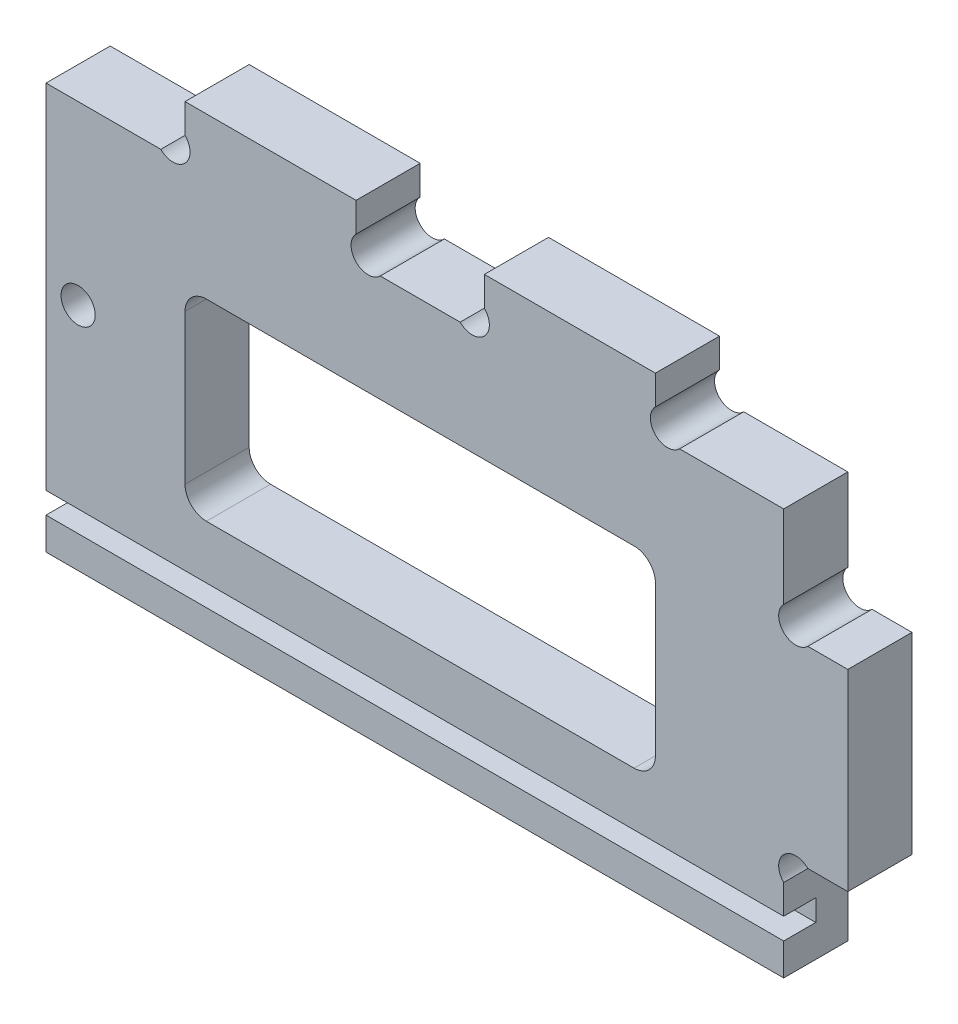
SolidWorks part; units mm, degrees
ref_plane "Plan de face" through (0, 0, 0) normal (0, 0, 1) x (1, 0, 0)
ref_plane "Plan de dessus" through (0, 0, 0) normal (0, 1, 0) x (1, 0, 0)
ref_plane "Plan de droite" through (0, 0, 0) normal (1, 0, 0) x (0, 0, -1)
sketch "Esquisse1" plane through (0, 0, 0) normal (0, 0, 1) x (1, 0, 0)
  line L0 (-27.4345, 0) -> (64.2056, 0) construction
  line L1 (-12, 47.038) -> (-12, 6.5173) construction
  line L2 (-6.6767, 43) -> (64.2056, 43) construction
  line L3 (44, 55.9741) -> (44, -5.7788) construction
  line L4 (44, 28) -> (53.9622, 37.9622) construction
  line L5 (24, 55.9741) -> (24, 15.7459) construction
  line L6 (64.2056, 38) -> (-31.4619, 38) construction
  line L7 (32, 48.6973) -> (32, 7.7373) construction
  line L8 (-14.7736, 28) -> (64.2056, 28) construction
  line L9 (-14.7736, 10) -> (64.2056, 10) construction
  line L10 (14.5822, 19) -> (64.2056, 19) construction
  line L11 (32, 38) -> (51.9587, 57.9587) construction
  line L12 (-25, -4.6271) -> (-25, 48.6973) construction
  line L13 (32, 40.2627) -> (32, 43)
  line L14 (16, 40.2627) -> (16, 43)
  line L15 (16, 43) -> (32, 43)
  line L16 (34.2627, 38) -> (44, 38)
  line L17 (44, 38) -> (44, 30.2627)
  line L18 (46.2627, 28) -> (50, 28)
  line L19 (50, 28) -> (50, 10)
  line L20 (50, 10) -> (46.2627, 10)
  line L21 (44, 7.7373) -> (44, 0)
  line L22 (44, 0) -> (-25, 0)
  line L23 (10, 33.8225) -> (10, 50.6157) construction
  line L24 (-25, 38) -> (-14.2627, 38)
  line L25 (16, 48.6973) -> (16, -5.7788) construction
  line L26 (50, 34.6858) -> (50, -12.4171) construction
  line L27 (-22, 40.7332) -> (-22, 11.5469) construction
  line L28 (-10, 28) -> (30, 28)
  line L29 (-12, 26) -> (-12, 12)
  line L30 (-10, 10) -> (30, 10)
  line L31 (4, 43) -> (-12, 43)
  line L32 (4, 40.2627) -> (4, 43)
  line L33 (-12, 40.2627) -> (-12, 43)
  line L34 (-25, 38) -> (-25, 0)
  line L35 (6.2627, 38) -> (13.7373, 38)
  line L36 (32, 26) -> (32, 12)
  line L37 (-28.5874, 21.5) -> (-20.5116, 21.5) construction
  line L38 (-30.4293, 5) -> (8.7455, 5) construction
  arc A0 (44, 30.2627) -> (46.2627, 28) centre (45.1314, 29.1314) ccw
  arc A1 (32, 40.2627) -> (34.2627, 38) centre (33.1314, 39.1314) ccw
  arc A2 (44, 7.7373) -> (46.2627, 10) centre (45.1314, 8.8686) cw
  arc A3 (16, 40.2627) -> (13.7373, 38) centre (14.8686, 39.1314) cw
  arc A4 (-10, 28) -> (-12, 26) centre (-10, 26) ccw
  arc A5 (-12, 12) -> (-10, 10) centre (-10, 12) ccw
  arc A6 (30, 10) -> (32, 12) centre (30, 12) ccw
  arc A7 (30, 28) -> (32, 26) centre (30, 26) cw
  arc A8 (-12, 40.2627) -> (-14.2627, 38) centre (-13.1314, 39.1314) cw
  arc A9 (4, 40.2627) -> (6.2627, 38) centre (5.1314, 39.1314) ccw
  circle A10 centre (-22, 21.5) radius 1.6
  dimension "D10" = 33
  dimension "D9" = 2
  dimension "D1" = 6
  dimension "D2" = 5
  dimension "D3" = 20
  dimension "D4" = 10
  dimension "D5" = 45
  dimension "D6" = 19
  dimension "D7" = 8
  dimension "D8" = 45
  dimension "D11" = 43
  dimension "D12" = 6
  dimension "D13" = 69
  dimension "D14" = 3
  dimension "D15" = 16.5
extrude "Extrusion1" add sketch "Esquisse1" along normal blind 6
sketch "Esquisse2" plane through (0, 0, 6) normal (0, 0, 1) x (1, 0, 0)
  line L0 (-31.5627, 0) -> (46.22, 0) construction
  line L2 (46.22, 3) -> (-31.5627, 3) construction
  line L3 (-25, 5) -> (44, 5)
  line L4 (-31.5627, 5) -> (46.22, 5) construction
  line L5 (-25, 5) -> (-25, 3)
  line L6 (-25, 3) -> (44, 3)
  line L7 (44, 5) -> (44, 3)
  dimension "D1" = 3
  dimension "D2" = 2
extrude "Enlèv. mat.-Extru.1" cut sketch "Esquisse2" against normal blind 3
